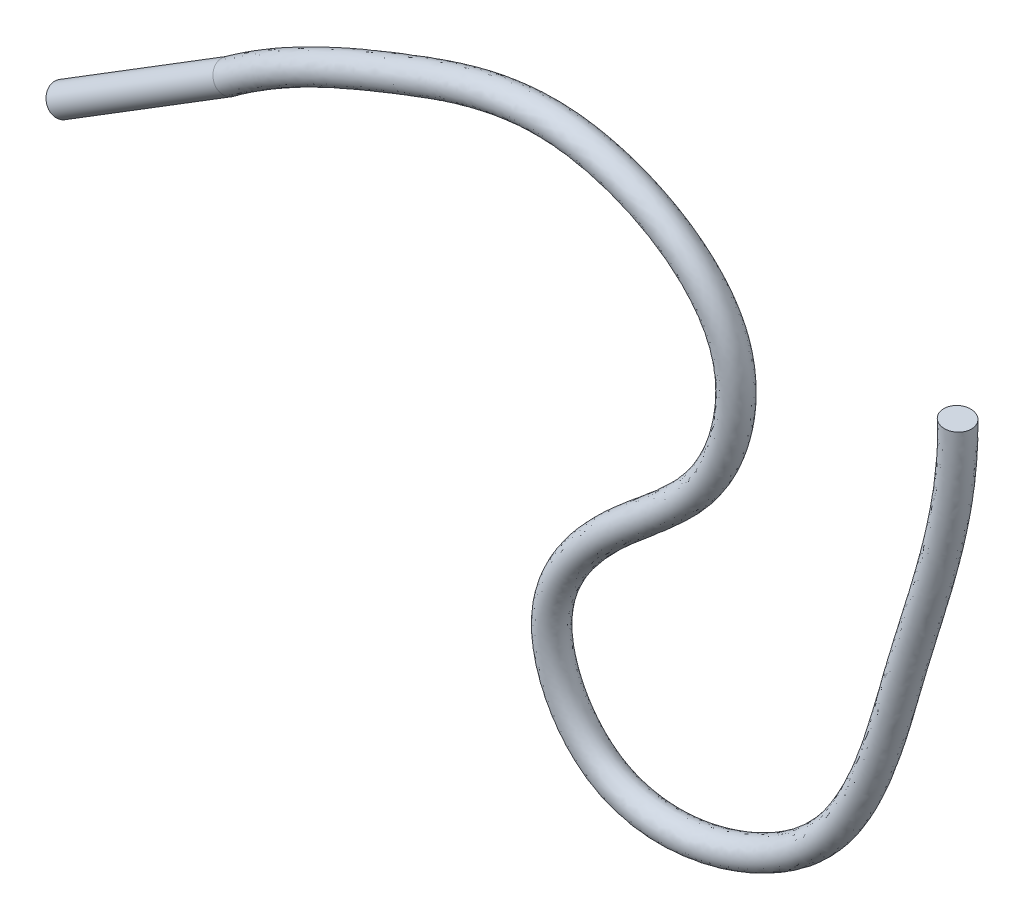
SolidWorks part; units mm, degrees
ref_plane "Face" through (0, 0, 0) normal (0, 0, 1) x (1, 0, 0)
ref_plane "Dessus" through (0, 0, 0) normal (0, 1, 0) x (1, 0, 0)
ref_plane "Droite" through (0, 0, 0) normal (1, 0, 0) x (0, 0, -1)
sketch "Esquisse2" plane through (-0.4895, 0.7902, -17.3788) normal (0.0281, -0.0454, 0.9986) x (0.9996, 0.0006, -0.0281)
  spline S0 degree 3 poles (-319.5027, 185.3786) (-300.2015, 199.5192) (-261.6038, 216.3999) (-198.1293, 237.4057) (-133.3988, 197.7206) (-150.9123, 133.1847) (-191.123, 108.021) (-220.3526, 67.8702) (-194.0802, 7.6962) (-130.9801, 26.7003) (-101.0916, 68.3334) (-85.3543, 125.6324) (-66.936, 171.7205) (-66.3032, 202.7121) knots 0 0 0 0 0.112978 0.202544 0.311899 0.391905 0.470296 0.539959 0.607589 0.721665 0.763002 0.854379 1 1 1 1
sketch "Esquisse3" plane through (-147.8988, -91.6238, 0) normal (0.8501, 0.5266, 0) x (0, 0, -1)
  circle A0 centre (0, 325.85) radius 5.1367 construction
  circle A1 centre (0, 325.85) radius 5.1367
sweep "Balayage1" add profiles "Esquisse3" path "Esquisse2"
sketch "Esquisse4" plane through (-147.8988, -91.6238, 0) normal (-0.8501, -0.5266, 0) x (0, 0, 1)
  circle A1 centre (0, 325.85) radius 5.1367
  circle A2 centre (0, 325.85) radius 5.1367
  dimension "D1" = 0
extrude "Boss.-Extru.1" add sketch "Esquisse4" along normal blind 70
